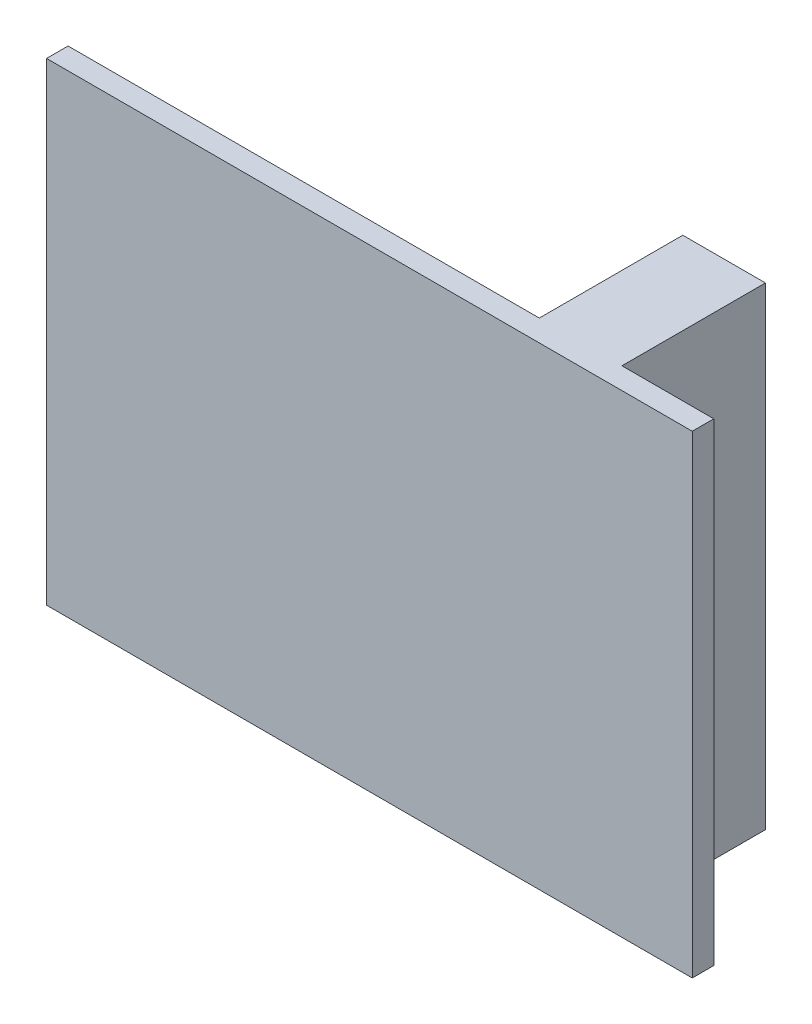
SolidWorks part; units mm, degrees
ref_plane "Plan de face" through (0, 0, 0) normal (0, 0, 1) x (1, 0, 0)
ref_plane "Plan de dessus" through (0, 0, 0) normal (0, 1, 0) x (1, 0, 0)
ref_plane "Plan de droite" through (0, 0, 0) normal (1, 0, 0) x (0, 0, -1)
sketch "Esquisse1" plane through (0, 0, 0) normal (0, 0, 1) x (1, 0, 0)
  line L1 (-53.0981, 29.2888) -> (-8.0981, 29.2888)
  line L2 (-53.0981, 29.2888) -> (-53.0981, -3.7112)
  line L3 (-53.0981, -3.7112) -> (-8.0981, -3.7112)
  line L4 (-8.0981, 29.2888) -> (-8.0981, -3.7112)
  dimension "D1" = 45
  dimension "D2" = 33
extrude "Boss.-Extru.1" add sketch "Esquisse1" along normal blind 1.5
sketch "Esquisse2" plane through (0, 0, 0) normal (0, 0, -1) x (-1, 0, 0)
  line L0 (8.0981, 29.2888) -> (53.0981, 29.2888) construction
  line L1 (14.4981, 29.2888) -> (20.2581, 29.2888)
  line L2 (14.4981, 29.2888) -> (14.4981, -3.7112)
  line L3 (14.4981, -3.7112) -> (20.2581, -3.7112)
  line L4 (20.2581, 29.2888) -> (20.2581, -3.7112)
  line L5 (53.0981, -3.7112) -> (8.0981, -3.7112) construction
  line L6 (8.0981, -3.7112) -> (8.0981, 29.2888) construction
  dimension "D1" = 5.76
  dimension "D2" = 0
  dimension "D3" = 0
  dimension "D4" = 6.4
extrude "Boss.-Extru.2" add sketch "Esquisse2" along normal blind 10
